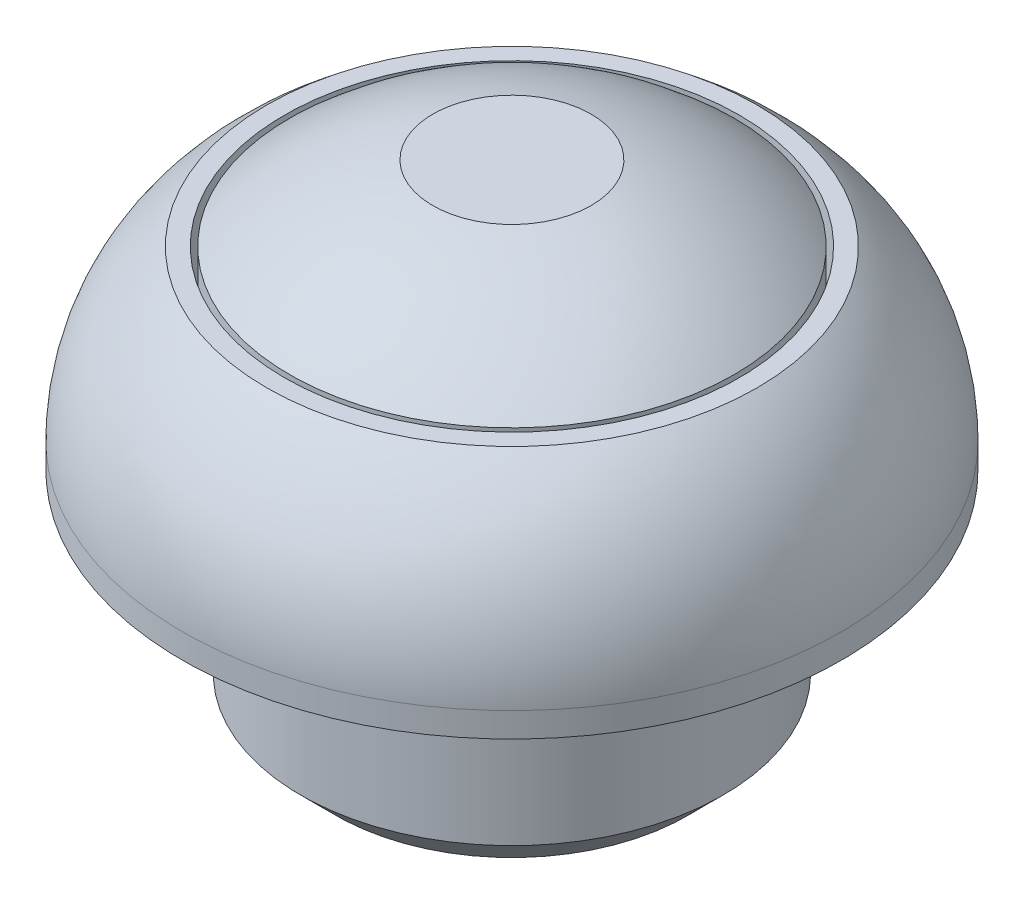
SolidWorks part; units mm, degrees
ref_plane "Спереди" through (0, 0, 0) normal (0, 0, 1) x (1, 0, 0)
ref_plane "Сверху" through (0, 0, 0) normal (0, 1, 0) x (1, 0, 0)
ref_plane "Справа" through (0, 0, 0) normal (1, 0, 0) x (0, 0, -1)
sketch "Sketch1" plane through (0, 0, 0) normal (0, 0, 1) x (1, 0, 0)
  line L0 (0, 0) -> (0, 6.7)
  line L1 (0, 6.7) -> (6.4619, 6.7)
  line L2 (6.4619, 6.7) -> (6.4619, 11.5)
  line L3 (6.4619, 11.5) -> (6.9619, 11.5)
  line L4 (0, 0) -> (6, 0)
  line L5 (6, 0) -> (6, 6)
  line L6 (6, 6) -> (9.3619, 6)
  line L7 (9.3619, 6) -> (9.3619, 6.7)
  line L8 (0, 0) -> (0, 15.8103) construction
  line L9 (0, 7.5) -> (6.3119, 7.5)
  line L10 (6.3119, 7.5) -> (6.3119, 11.5)
  line L11 (0, 13.6297) -> (0, 7.5)
  line L12 (2.25, 13.6297) -> (0, 13.6297)
  arc A0 (6.9619, 11.5) -> (9.3619, 6.7) centre (3.3619, 6.7) cw
  arc A1 (6.3119, 11.5) -> (2.25, 13.6297) centre (0, 4.4) ccw
  dimension "D5" = 9.5
  dimension "D10" = 6
  dimension "D1" = 12
  dimension "D2" = 6
  dimension "D3" = 5.5
  dimension "D4" = 0.5
  dimension "D6" = 4
  dimension "D7" = 0.8
  dimension "D8" = 0.15
  dimension "D9" = 4.4
  dimension "D11" = 4.5
revolve "Revolve1" add sketch "Sketch1" angle 360 about L8
chamfer "Chamfer1" distance 1 angle 45 1 edges at (0, 0, -6)
